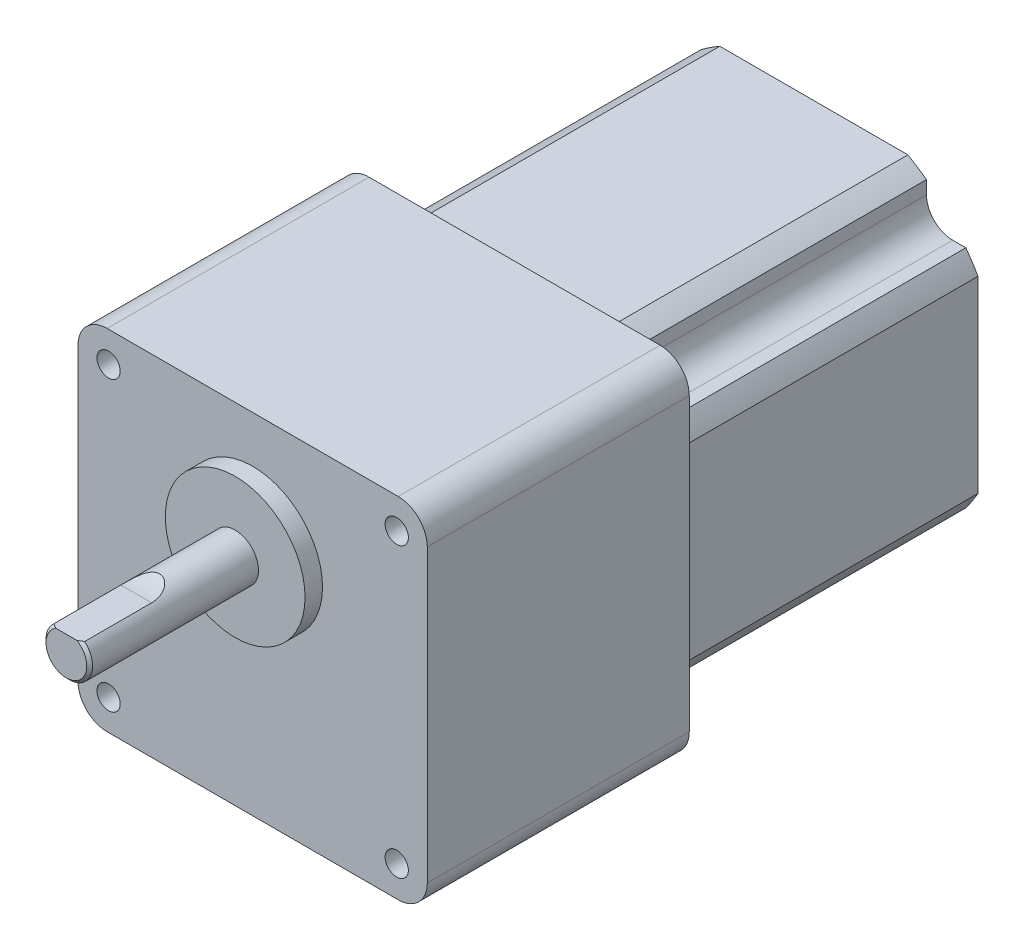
SolidWorks part; units mm, degrees
ref_plane "Front" through (0, 0, 0) normal (0, 0, 1) x (1, 0, 0)
ref_plane "Top" through (0, 0, 0) normal (0, 1, 0) x (1, 0, 0)
ref_plane "Right" through (0, 0, 0) normal (1, 0, 0) x (0, 0, -1)
sketch "Sketch1" plane through (0, 0, 0) normal (0, 0, 1) x (1, 0, 0)
  circle A0 centre (0, 0) radius 12
  dimension "D1" = 24
extrude "Extrude1" add sketch "Sketch1" along normal blind 3
sketch "Sketch2" plane through (0, 0, 3) normal (0, 0, 1) x (1, 0, 0)
  circle A0 centre (0, 0) radius 4
  dimension "D1" = 8
extrude "Extrude2" add sketch "Sketch2" along normal blind 29
chamfer "Chamfer1" distance 0.5 angle 45 1 edges at (4, 0, 32)
sketch "Sketch3" plane through (0, 0, 0) normal (1, 0, 0) x (0, 0, -1)
  line L0 (-32, 3) -> (-20, 3)
  line L1 (-32, 4) -> (-32, -4) construction
  line L2 (-20, 3) -> (-20, 11.5)
  line L3 (-20, 11.5) -> (-32, 11.5)
  line L4 (-32, 11.5) -> (-32, 3)
  line L5 (0, 0) -> (-32, 0) construction
  line L6 (-32, 4) -> (-7.262, 4) construction
  line L7 (-3, 4) -> (-31.5, 4) construction
  line L8 (-16, 4) -> (-16, 0) construction
  circle A0 centre (-20, 11.5) radius 8.5
  dimension "D1" = 3
  dimension "D2" = 12
  dimension "D3" = 16
extrude "Extrude3" cut sketch "Sketch3" against normal mid plane 10 contours A0 L3 L4 L0 | L3 A0 L2 | L2 A0 L3
sketch "Sketch4" plane through (0, 0, 0) normal (0, 0, -1) x (-1, 0, 0)
  line L0 (0, 0) -> (0, -10) construction
  line L1 (-25, -40) -> (25, -40)
  line L2 (-30, -35) -> (-30, 15)
  line L3 (-25, 20) -> (25, 20)
  line L4 (30, -35) -> (30, 15)
  line L5 (-30, -40) -> (30, 20) construction
  line L6 (-30, 20) -> (30, -40) construction
  arc A0 (30, -35) -> (25, -40) centre (25, -35) cw
  arc A1 (-25, -40) -> (-30, -35) centre (-25, -35) cw
  arc A2 (30, 15) -> (25, 20) centre (25, 15) ccw
  arc A3 (-25, 20) -> (-30, 15) centre (-25, 15) ccw
  point P0 (0, -10)
  dimension "D4" = 5
  dimension "D1" = 60
  dimension "D2" = 60
  dimension "D3" = 10
extrude "Extrude4" add sketch "Sketch4" along normal blind 45
sketch "Sketch6" plane through (0, 0, -45) normal (0, 0, -1) x (-1, 0, 0)
  line L0 (-32.5, -10) -> (32.5, -10) construction
  line L3 (0, 22.5) -> (0, -40.337) construction
  line L7 (28.2, -29.35) -> (-28.2, -29.35)
  line L8 (28.2, -29.35) -> (28.2, 9.35)
  line L9 (28.2, 9.35) -> (-28.2, 9.35)
  line L10 (-28.2, -29.35) -> (-28.2, 9.35)
  line L11 (28.2, -29.35) -> (-28.2, 9.35) construction
  line L12 (28.2, 9.35) -> (-28.2, -29.35) construction
  line L13 (-19.35, 18.2) -> (19.35, 18.2)
  line L14 (-19.35, 18.2) -> (-19.35, -38.2)
  line L15 (-19.35, -38.2) -> (19.35, -38.2)
  line L16 (19.35, 18.2) -> (19.35, -38.2)
  line L17 (-19.35, 18.2) -> (19.35, -38.2) construction
  line L18 (-19.35, -38.2) -> (19.35, 18.2) construction
  circle A0 centre (0, -10) radius 32.5
  dimension "D1" = 65
  dimension "D2" = 56.4
  dimension "D3" = 38.7
  dimension "D4" = 38.7
  dimension "D5" = 56.4
  dimension "D6" = 10
extrude "Extrude6" add sketch "Sketch6" along normal blind 51.4 contours L9 A0 L10 L7 L14 | L16 A0 L13 L14 L9 | L8 A0 L9 L16 L7 | L14 A0 L15 L16 L7 | L16 L9 L14 L7
fillet "Fillet1" radius 4.5 4 edges at (19.35, -29.35, -70.7) (-19.35, -29.35, -70.7) (-19.35, 9.35, -70.7) (19.35, 9.35, -70.7)
sketch "Sketch10" plane through (0, 0, 0) normal (0, 0, 1) x (1, 0, 0)
  line L1 (-24.7487, 14.7487) -> (24.7487, 14.7487) construction
  line L2 (-24.7487, 14.7487) -> (-24.7487, -34.7487) construction
  line L3 (-24.7487, -34.7487) -> (24.7487, -34.7487) construction
  line L4 (24.7487, 14.7487) -> (24.7487, -34.7487) construction
  line L5 (-24.7487, 14.7487) -> (24.7487, -34.7487) construction
  line L6 (-24.7487, -34.7487) -> (24.7487, 14.7487) construction
  circle A0 centre (0, -10) radius 35 construction
  circle A1 centre (24.7487, 14.7487) radius 2
  circle A2 centre (-24.7487, 14.7487) radius 2
  circle A3 centre (-24.7487, -34.7487) radius 2
  circle A4 centre (24.7487, -34.7487) radius 2
  point P0 (0, -10)
  dimension "D1" = 70
  dimension "D4" = 4
  dimension "D2" = 10
  dimension "D3" = 90
extrude "Extrude10" cut sketch "Sketch10" against normal blind 8
